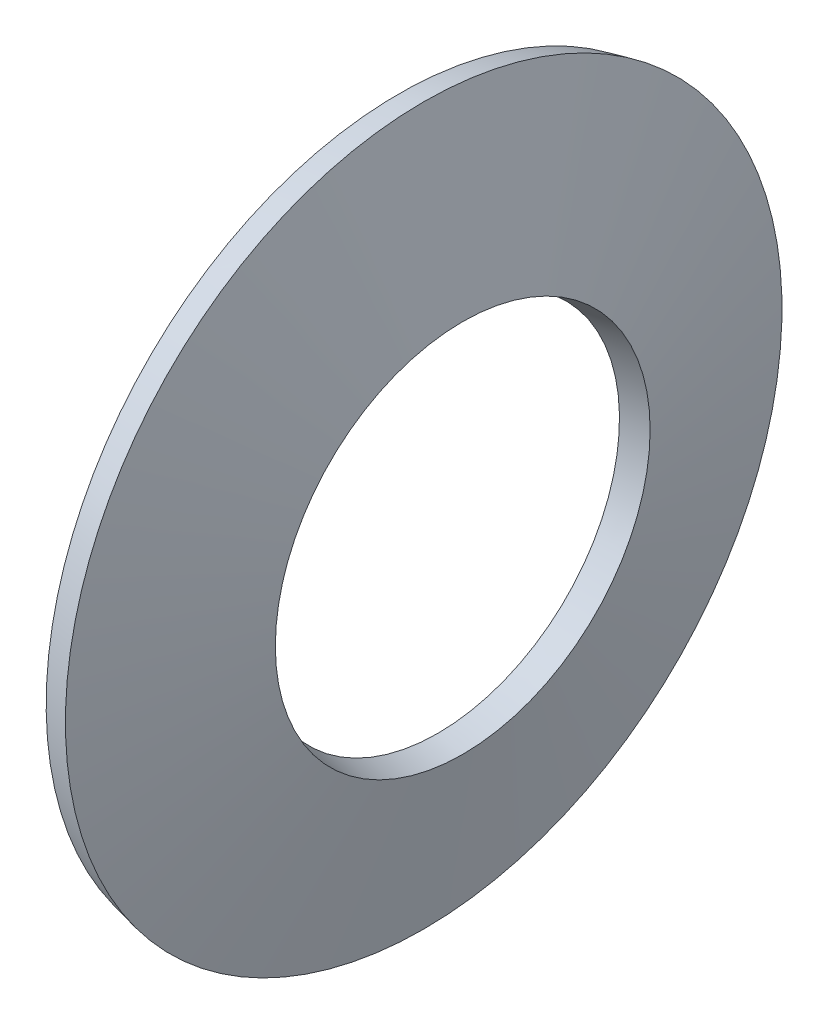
SolidWorks part; units mm, degrees
ref_plane "Plan1" through (0, 0, 0) normal (0, 0, 1) x (1, 0, 0)
ref_plane "Plan2" through (0, 0, 0) normal (0, 1, 0) x (1, 0, 0)
ref_plane "Plan3" through (0, 0, 0) normal (1, 0, 0) x (0, 0, -1)
sketch "Esquisse2" plane through (0, 0, 0) normal (0, 0, 1) x (1, 0, 0)
  line L0 (0, 13.7773) -> (1.5251, 7.1)
  line L1 (1.5251, 7.1) -> (2.5, 7.3227)
  line L2 (2.5, 7.3227) -> (0.9749, 14)
  line L3 (0.9749, 14) -> (0, 13.7773)
  line L4 (0, 0) -> (2.5, 0) construction
  dimension "de" = 14
  dimension "d" = 7.1
  dimension "e" = 1
  dimension "h" = 2.5
revolve "Base-Révolution" add sketch "Esquisse2" angle 360 about L4
